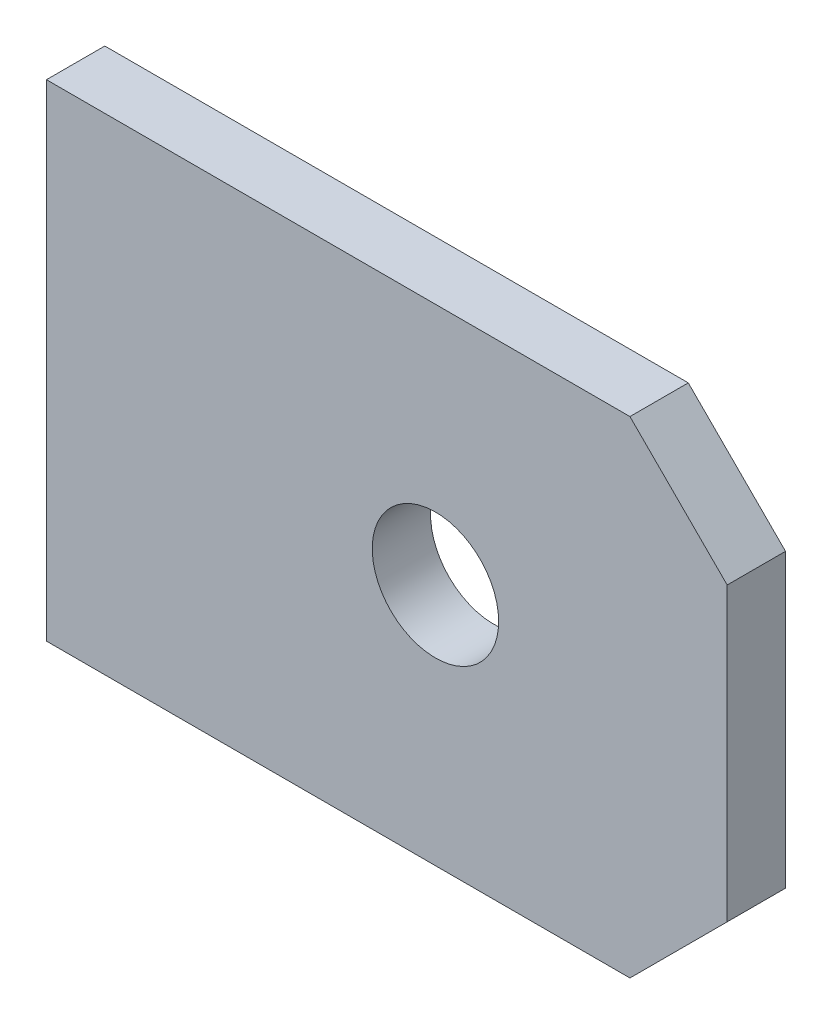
SolidWorks part; units mm, degrees
ref_plane "Face" through (0, 0, 0) normal (0, 0, 1) x (1, 0, 0)
ref_plane "Dessus" through (0, 0, 0) normal (0, 1, 0) x (1, 0, 0)
ref_plane "Droite" through (0, 0, 0) normal (1, 0, 0) x (0, 0, -1)
sketch "Esquisse1" plane through (0, 0, 0) normal (0, 0, 1) x (1, 0, 0)
  line L0 (120, 0) -> (140, -20)
  line L1 (0, 0) -> (120, 0)
  line L2 (0, 0) -> (0, -100)
  line L3 (0, -100) -> (120, -100)
  line L4 (140, -20) -> (140, -80)
  line L5 (140, -80) -> (120, -100)
  circle A0 centre (80, -50) radius 13
  point P1 (140, -100)
  point P3 (140, 0)
  dimension "D3" = 26
  dimension "D1" = 140
  dimension "D2" = 100
  dimension "D5" = 20
  dimension "D6" = 20
  dimension "D4" = 80
  dimension "D7" = 50
extrude "Base-Extrusion" add sketch "Esquisse1" along normal blind 12
